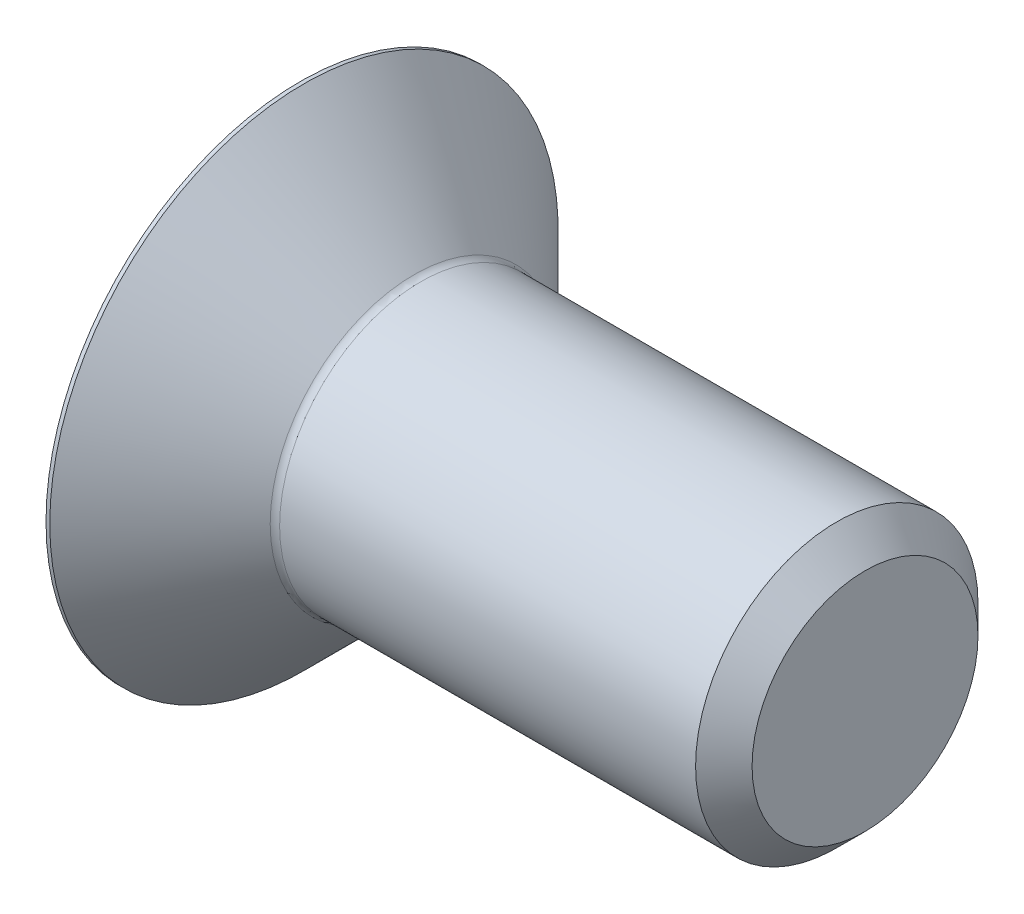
SolidWorks part; units mm, degrees
ref_plane "Plane1" through (0, 0, 0) normal (0, 0, 1) x (1, 0, 0)
ref_plane "Plane2" through (0, 0, 0) normal (0, 1, 0) x (1, 0, 0)
ref_plane "Plane3" through (0, 0, 0) normal (1, 0, 0) x (0, 0, -1)
sketch "BodySke" plane through (0, 0, 0) normal (0, 0, 1) x (1, 0, 0)
  line L0 (0, 0) -> (0, 5.4)
  line L1 (0.08, 5.4) -> (2.48, 3)
  line L2 (0, 5.4) -> (0.08, 5.4)
  line L3 (2.48, 3) -> (11.4, 3)
  line L4 (12, 2.4) -> (12, 0)
  line L5 (12, 0) -> (0, 0)
  line L6 (0, 0) -> (127, 0) construction
  line L7 (0.08, -5.4) -> (2.48, -3) construction
  line L8 (12, 2.4) -> (11.4, 3)
  line L9 (0, -5.4) -> (0.08, -5.4) construction
  line L10 (12, -2.4) -> (11.4, -3) construction
  line L11 (3.18, 9.35) -> (3.18, -12.875) construction
  line L12 (0, 19.05) -> (0, -3.175) construction
  dimension "D1" = 0.08
  dimension "Diameter" = 6
  dimension "Head_ht" = 2.48
  dimension "Length" = 12
  dimension "Body_ch_ang" = 45
  dimension "Head_dia" = 10.8
  dimension "Minor_dia" = 4.8
  dimension "Head_ang" = 90
  dimension "Advance" = 0.7
  dimension "Thread_nom" = 12
revolve "BaseBody" add sketch "BodySke" angle 360 about L6
fillet "Fillet1" radius 0.2 1 edges at (2.48, 0, 3)
sketch "Sketch2" plane through (0, 0, 0) normal (0, 0, 1) x (1, 0, 0)
  line L0 (0, 1.25) -> (1.5, 1.25)
  line L1 (1.5, 1.25) -> (2.2217, 0)
  line L2 (0, 0) -> (127, 0) construction
  line L3 (2.2217, 0) -> (0, 0)
  line L4 (0, 0) -> (0, 1.25)
  line L5 (0, -1.25) -> (1.5, -1.25) construction
  line L6 (0, 0) -> (47.625, 0) construction
  line L8 (0, 5.4) -> (0, -5.4) construction
  dimension "D2" = 60
  dimension "PreBroach_depth" = 1.5
  dimension "PreBroach_dia" = 2.5
revolve "PreBroach" cut sketch "Sketch2" angle 360 about L6
sketch "Sketch3" plane through (0, 0, 0) normal (-1, 0, 0) x (0, 0, 1)
  line L0 (-2, -1.1547) -> (-2, 1.1547)
  line L1 (-2, 1.1547) -> (0, 2.3094)
  line L2 (0, 2.3094) -> (2, 1.1547)
  line L3 (2, 1.1547) -> (2, -1.1547)
  line L4 (2, -1.1547) -> (0, -2.3094)
  line L5 (0, -2.3094) -> (-2, -1.1547)
  dimension "D1" = 2
  dimension "D2" = 2
  dimension "D3" = 4
  dimension "Hex_size" = 4
extrude "Hex" cut sketch "Sketch3" against normal blind 1.5
sketch "ThdSchSke" plane through (0, 0, 0) normal (0, 0, 1) x (1, 0, 0)
  line L0 (4.58, -2.4) -> (4.1599, -3)
  line L1 (4.58, -2.4) -> (5.0001, -3)
  line L2 (5.0001, -3) -> (5.0001, -3.75)
  line L3 (-3.175, 0) -> (5.1513, 0) construction
  line L4 (0, 5.4) -> (0, -5.4) construction
  line L5 (5.0001, -3.75) -> (4.1599, -3.75)
  line L6 (4.1599, -3.75) -> (4.1599, -3)
  dimension "Thread_minor" = 4.8
  dimension "Diameter" = 6
  dimension "Start" = 4.58
  dimension "SideAngle" = 55
  dimension "VeeAngle" = 70
  dimension "Overcut" = 7.5
revolve "ThreadSchematic" [suppressed] cut sketch "ThdSchSke" angle 360 about L3
pattern_linear "ThdSchPat" [suppressed]
equation "\"Thread_minor@ThreadCosmetic\"  =  \"Minor_dia@BodySke\""
equation "\"D1@Sketch3\" = \"Hex_size@Sketch3\" / 2"
equation "\"D2@Sketch3\" = \"D1@Sketch3\""
equation "\"D3@Sketch3\" = \"Hex_size@Sketch3\""
equation "\"Thread_length@ThreadCosmetic\" = ((sgn( (\"Length@BodySke\" - \"Advance@BodySke\" * 3.0 - \"Head_ht@BodySke\" ) - \"Thread_nom@BodySke\" )-1)*( (\"Length@BodySke\" - \"Advance@BodySke\" * 3.0 - \"Head_ht@BodySke\" "
equation "\"Thread_minor@ThdSchSke\" = \"Minor_dia@BodySke\""
equation "\"Diameter@ThdSchSke\" = \"Diameter@BodySke\""
equation "\"Overcut@ThdSchSke\" = \"Diameter@BodySke\" * 1.25"
equation "\"Start@ThdSchSke\" = 0.000001 + \"Length@BodySke\" - \"Thread_length@ThreadCosmetic\"  '---Countersunk---"
equation "\"Num_threads@ThdSchPat\" = int( \"Thread_length@ThreadCosmetic\" / \"Advance@BodySke\" + 0.999 )  + 1"
equation "\"Advance@ThdSchPat\" = \"Thread_length@ThreadCosmetic\" /  (\"Num_threads@ThdSchPat\" - 1) 'relax it"
equation "\"Num_threads@ThdSchPat\" = \"Num_threads@ThdSchPat\" - sgn( \"Num_threads@ThdSchPat\" - 1) '---chamfered tips only---"
